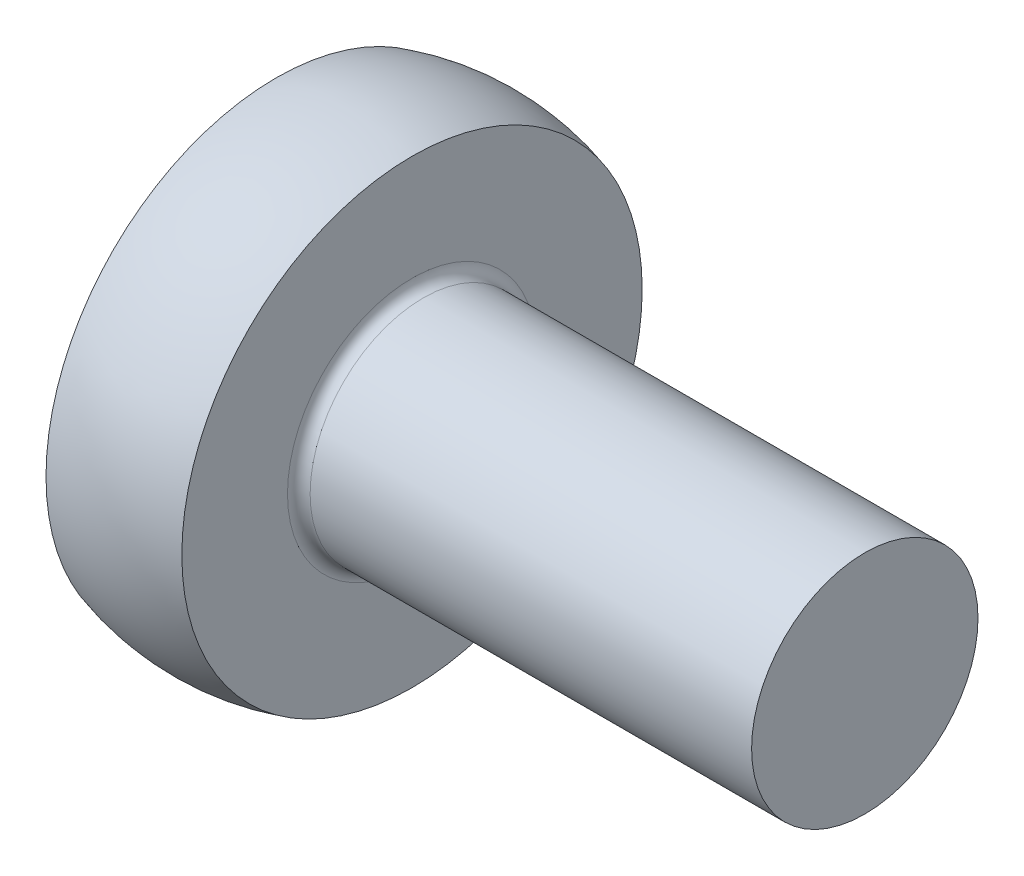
SolidWorks part; units mm, degrees
ref_plane "Front" through (0, 0, 0) normal (0, 0, 1) x (1, 0, 0)
ref_plane "Top" through (0, 0, 0) normal (0, 1, 0) x (1, 0, 0)
ref_plane "Right" through (0, 0, 0) normal (1, 0, 0) x (0, 0, -1)
sketch "Sketch1" plane through (0, 0, 0) normal (0, 0, 1) x (1, 0, 0)
  line L0 (0, 2.0333) -> (0, 0)
  line L1 (1.2, 2.0333) -> (1.2, 1)
  line L2 (0, 0) -> (5.2, 0)
  line L3 (5.2, 0) -> (5.2, 1)
  line L4 (5.2, 1) -> (1.2, 1)
  line L5 (-2.3183, 0) -> (6.9456, 0) construction
  arc A0 (1.2, 2.0333) -> (0, 2.0333) centre (0.6, 0) ccw
  dimension "dk" = 4.24
  dimension "K" = 1.2
  dimension "D3" = 0.6
  dimension "l" = 4
  dimension "d" = 2
revolve "Base-Revolve" add sketch "Sketch1" angle 360 about L5
fillet "Fillet1" radius 0.1 1 edges at (1.2, 0, 1)
equation "\"D3@Sketch1\" = \"K@Sketch1\" / 2"
